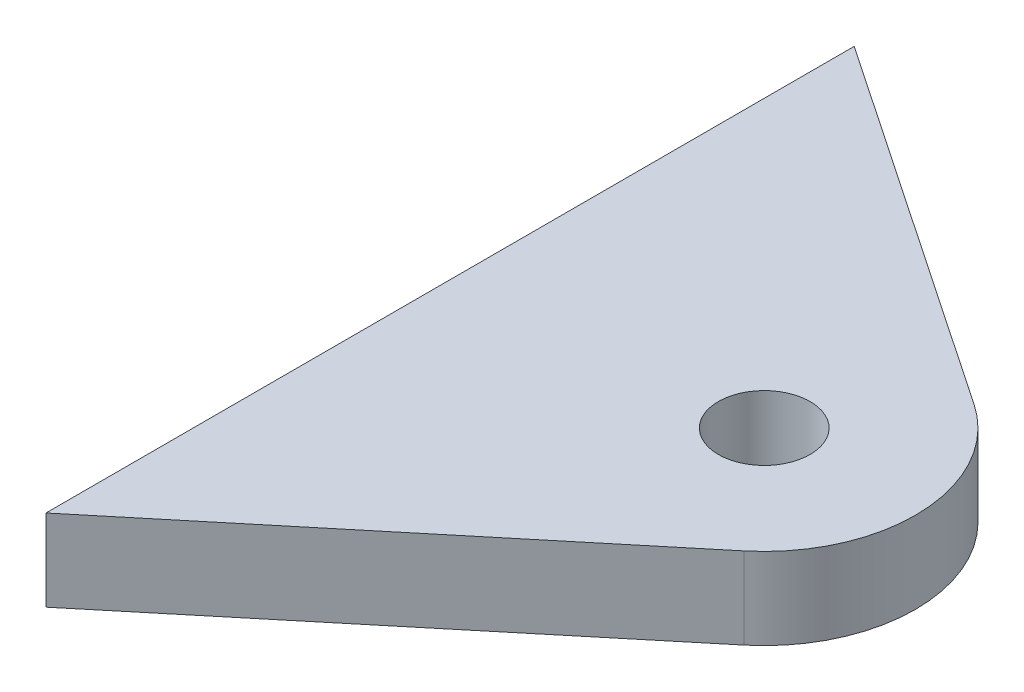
SolidWorks part; units mm, degrees
ref_plane "Front Plane" through (0, 0, 0) normal (0, 0, 1) x (1, 0, 0)
ref_plane "Top Plane" through (0, 0, 0) normal (0, 1, 0) x (1, 0, 0)
ref_plane "Right Plane" through (0, 0, 0) normal (1, 0, 0) x (0, 0, -1)
sketch "Sketch1" plane through (0, 0, 0) normal (0, 1, 0) x (1, 0, 0)
  line L0 (26.3611, 38.9905) -> (-88.9, 116.9175)
  line L1 (-88.9, 116.9175) -> (-88.9, -134.7093)
  line L2 (-88.9, -134.7093) -> (30.0155, -36.2525)
  line L3 (0, 133.0246) -> (0, -142.4634) construction
  circle A0 centre (0, 0) radius 14.2875
  arc A1 (30.0155, -36.2525) -> (26.3611, 38.9905) centre (0, 0) ccw
  dimension "D1" = 28.575
  dimension "D2" = 94.1312
  dimension "D3" = 88.9
extrude "Boss-Extrude1" add sketch "Sketch1" along normal blind 25.4
